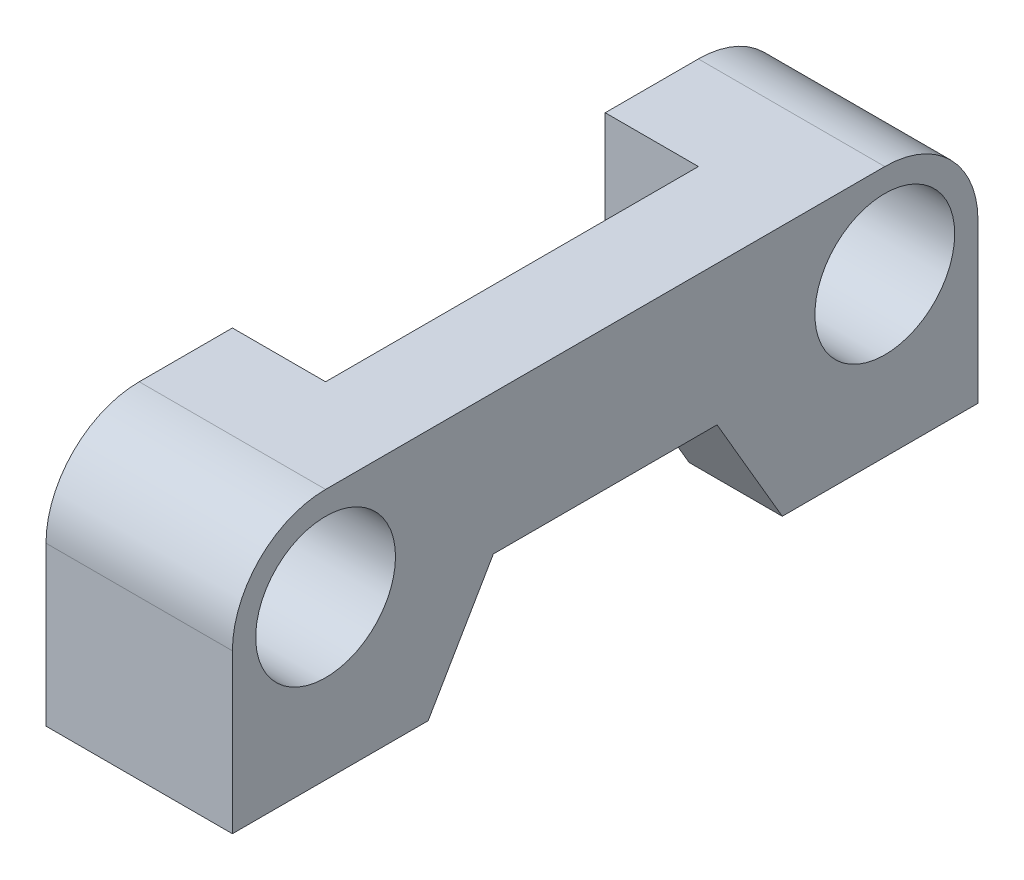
SolidWorks part; units mm, degrees
ref_plane "Front Plane" through (0, 0, 0) normal (0, 0, 1) x (1, 0, 0)
ref_plane "Top Plane" through (0, 0, 0) normal (0, 1, 0) x (1, 0, 0)
ref_plane "Right Plane" through (0, 0, 0) normal (1, 0, 0) x (0, 0, -1)
sketch "Sketch1" plane through (0, 0, 0) normal (1, 0, 0) x (0, 0, -1)
  line L0 (-19, -13.5) -> (-12, -1.5)
  line L1 (40, -13.5) -> (19, -13.5)
  line L2 (40, -13.5) -> (40, 3.5)
  line L3 (30, 13.5) -> (-30, 13.5)
  line L4 (-40, -13.5) -> (-40, 3.5)
  line L5 (40, -13.5) -> (-40, 13.5) construction
  line L6 (40, 13.5) -> (-40, -13.5) construction
  line L7 (-12, -1.5) -> (12, -1.5)
  line L8 (12, -1.5) -> (19, -13.5)
  line L9 (-19, -13.5) -> (-40, -13.5)
  arc A0 (-30, 13.5) -> (-40, 3.5) centre (-30, 3.5) ccw
  arc A1 (40, 3.5) -> (30, 13.5) centre (30, 3.5) ccw
  circle A2 centre (-30, 3.5) radius 7.5
  circle A3 centre (30, 3.5) radius 7.5
  point P0 (0, 0)
  dimension "D8" = 10
  dimension "D9" = 10
  dimension "D10" = 60
  dimension "D1" = 80
  dimension "D2" = 27
  dimension "D3" = 15
  dimension "D4" = 24
  dimension "D5" = 21
  dimension "D6" = 21
  dimension "D7" = 12
extrude "Boss-Extrude1" add sketch "Sketch1" along normal blind 20
sketch "Sketch2" plane through (0, 13.5, 0) normal (0, 1, 0) x (1, 0, 0)
  line L0 (0, 30) -> (0, -30) construction
  line L1 (0, 20) -> (10, 20)
  line L2 (0, 20) -> (0, -20)
  line L3 (0, -20) -> (10, -20)
  line L4 (10, 20) -> (10, -20)
  dimension "D1" = 10
  dimension "D2" = 40
  dimension "D3" = 20
extrude "Cut-Extrude1" cut sketch "Sketch2" against normal through all
